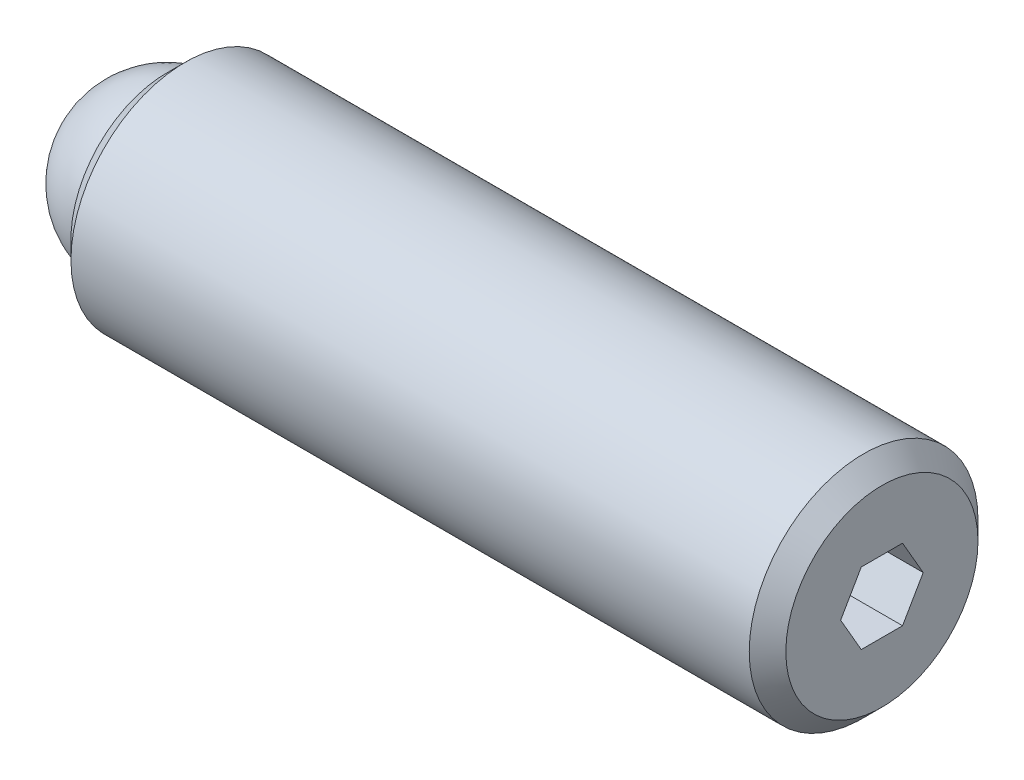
SolidWorks part; units mm, degrees
ref_plane "Front Plane" through (0, 0, 0) normal (0, 0, 1) x (1, 0, 0)
ref_plane "Top Plane" through (0, 0, 0) normal (0, 1, 0) x (1, 0, 0)
ref_plane "Right Plane" through (0, 0, 0) normal (1, 0, 0) x (0, 0, -1)
sketch "Sketch2" plane through (0, 0, 0) normal (1, 0, 0) x (0, 0, -1)
  circle A0 centre (0, 0) radius 3.175
  dimension "D1" = 6.35
extrude "Boss-Extrude1" add sketch "Sketch2" along normal blind 19.8438
sketch "Sketch3" plane through (0, 0, 0) normal (-1, 0, 0) x (0, 0, 1)
  circle A0 centre (0, 0) radius 2.3813
  dimension "D1" = 4.7625
chamfer "Chamfer1" distance 0.508 angle 45 1 edges at (0, 0, -3.175)
chamfer "Chamfer2" distance 0.508 angle 45 1 edges at (19.8438, 0, -3.175)
sketch "Sketch4" plane through (19.8438, 0, 0) normal (1, 0, 0) x (0, 0, -1)
  line L1 (1.1457, 0) -> (0.5728, 0.9922)
  line L2 (0.5728, 0.9922) -> (-0.5728, 0.9922)
  line L3 (-0.5728, 0.9922) -> (-1.1457, 0)
  line L4 (-1.1457, 0) -> (-0.5728, -0.9922)
  line L5 (-0.5728, -0.9922) -> (0.5728, -0.9922)
  line L6 (0.5728, -0.9922) -> (1.1457, 0)
  circle A0 centre (0, 0) radius 0.9922 construction
  dimension "D1" = 1.9844
extrude "Cut-Extrude2" cut sketch "Sketch4" against normal blind 2.286
extrude "Cut-Extrude3" cut sketch "Sketch3" against normal blind 1.9844
sketch "Sketch5" plane through (0, 0, 0) normal (-1, 0, 0) x (0, 0, 1)
  line L0 (0, 0) -> (0, -2.3813)
  line L1 (0, 0) -> (0, 2.3813)
  arc A0 (0, 2.3813) -> (0, -2.3813) centre (0, 0) ccw
  dimension "D1" = 2.3813
revolve "Revolve1" add sketch "Sketch5" angle 360 about L1
